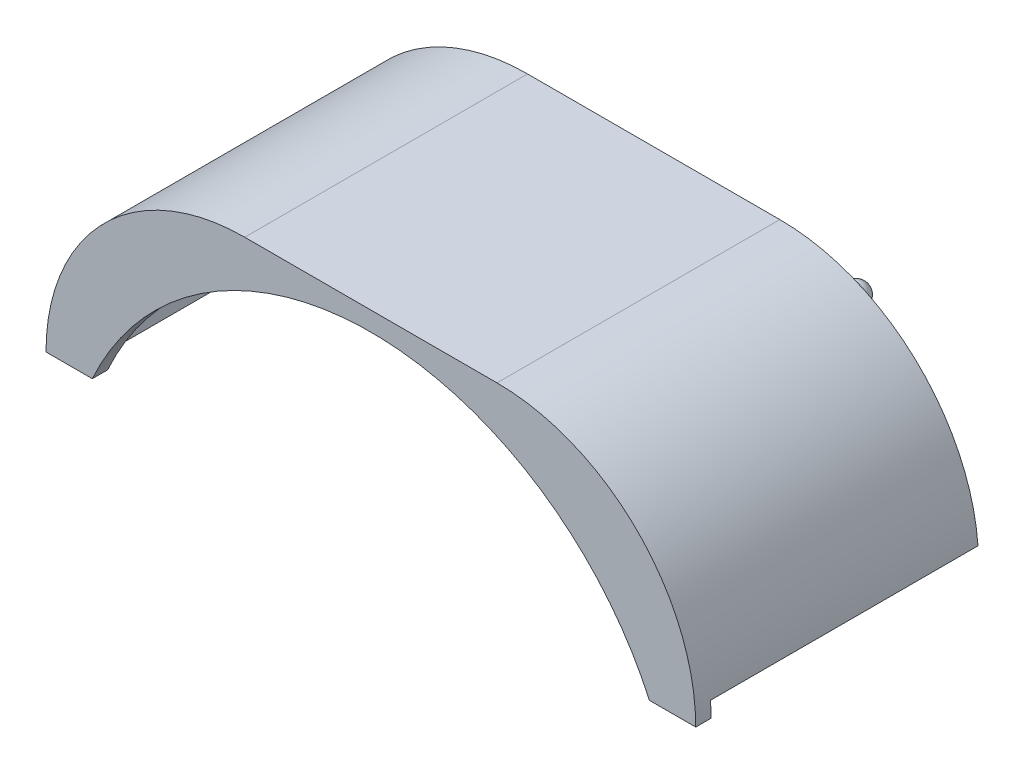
SolidWorks part; units mm, degrees
ref_plane "Face" through (0, 0, 0) normal (0, 0, 1) x (1, 0, 0)
ref_plane "Dessus" through (0, 0, 0) normal (0, 1, 0) x (1, 0, 0)
ref_plane "Droite" through (0, 0, 0) normal (1, 0, 0) x (0, 0, -1)
sketch "Esquisse2" plane through (-29.0881, 3.4934, 0) normal (0, 0, 1) x (1, 0, 0)
  line L0 (11.0881, 35.0066) -> (11.0881, 34.0066)
  line L2 (11.0881, 34.0066) -> (13.0881, 34.0066)
  line L3 (13.0881, 34.0066) -> (13.0881, 38.0066)
  line L4 (46.0881, 35.0066) -> (46.0881, 38.0016)
  line L5 (46.0881, 35.0066) -> (47.0881, 35.0066)
  line L8 (47.0881, 35.0066) -> (47.0881, 34.0066)
  line L9 (-10.4119, 13.0066) -> (-10.4119, 15.0066)
  line L10 (-10.4119, 15.0066) -> (-13.3349, 15.0066)
  line L11 (-10.4119, 13.0066) -> (-9.4119, 13.0066)
  line L13 (45.5881, 39.0066) -> (12.5881, 39.0066)
  line L14 (13.0881, 38.0066) -> (45.0881, 38.0066)
  line L15 (55.5881, 35.9195) -> (55.5881, 34.0066)
  line L16 (-9.4119, 13.0066) -> (-9.4119, 24.8809)
  line L17 (52.5881, 34.0066) -> (52.5881, 37.0066)
  line L18 (68.5881, 15.0066) -> (71.511, 15.0066)
  line L19 (5.5881, 37.0066) -> (5.5881, 34.0066)
  line L20 (68.5881, 15.0066) -> (68.5881, 13.0066)
  line L21 (2.5881, 34.0066) -> (2.5881, 35.9195)
  line L22 (68.5881, 13.0066) -> (67.5881, 13.0066)
  line L24 (67.5881, 13.0066) -> (67.5881, 24.8809)
  line L25 (12.0881, 35.0066) -> (12.0881, 38.0016)
  line L26 (12.0881, 35.0066) -> (11.0881, 35.0066)
  line L28 (47.0881, 34.0066) -> (45.0881, 34.0066)
  line L29 (45.0881, 34.0066) -> (45.0881, 38.0066)
  line L30 (68.5881, 13.0066) -> (68.5881, 15.0066) construction
  line L31 (70.508, 15.0066) -> (68.5881, 15.0066) construction
  line L32 (65.5264, 13.0066) -> (70.5881, 13.0066) construction
  line L33 (-10.4119, 13.0066) -> (-10.4119, 15.0066) construction
  line L34 (-10.4119, 15.0066) -> (-12.3318, 15.0066) construction
  line L35 (-12.4119, 13.0066) -> (-7.3502, 13.0066) construction
  line L36 (45.5881, 39.0066) -> (12.5881, 39.0066) construction
  line L37 (12.0881, 35.0066) -> (11.0881, 35.0066) construction
  line L38 (11.0881, 35.0066) -> (11.0881, 32.2277) construction
  line L39 (14.0881, 38.0066) -> (12.5881, 38.0066) construction
  line L40 (12.0881, 36.0066) -> (12.0881, 35.0066) construction
  line L41 (47.0881, 32.2277) -> (47.0881, 35.0066) construction
  line L42 (47.0881, 35.0066) -> (46.0881, 35.0066) construction
  line L43 (46.0881, 35.0066) -> (46.0881, 36.0066) construction
  arc A4 (67.5881, 24.8809) -> (55.5881, 35.9195) centre (45.5881, 13.0066) ccw
  arc A5 (12.0881, 38.0016) -> (5.5881, 37.0066) centre (12.5881, 13.0066) ccw
  arc A6 (12.5881, 39.0066) -> (-13.3349, 15.0066) centre (12.5881, 13.0066) ccw
  arc A7 (71.511, 15.0066) -> (45.5881, 39.0066) centre (45.5881, 13.0066) ccw
  arc A10 (2.5881, 34.0066) -> (5.5881, 34.0066) centre (4.0881, 34.0066) ccw
  arc A11 (52.5881, 34.0066) -> (55.5881, 34.0066) centre (54.0881, 34.0066) ccw
  arc A12 (2.5881, 35.9195) -> (-9.4119, 24.8809) centre (12.5881, 13.0066) ccw
  arc A13 (52.5881, 37.0066) -> (46.0881, 38.0016) centre (45.5881, 13.0066) ccw
  arc A14 (71.5881, 13.0066) -> (45.5881, 39.0066) centre (45.5881, 13.0066) ccw construction
  arc A15 (70.508, 15.0066) -> (45.5881, 38.0066) centre (45.5881, 13.0066) ccw construction
  circle A16 centre (54.0881, 34.0066) radius 1.5 construction
  arc A17 (12.5881, 38.0066) -> (-12.3318, 15.0066) centre (12.5881, 13.0066) ccw construction
  circle A18 centre (4.0881, 34.0066) radius 1.5 construction
  arc A19 (12.5881, 39.0066) -> (-13.4119, 13.0066) centre (12.5881, 13.0066) ccw construction
  dimension "D1" = 1
  dimension "D2" = 1
  dimension "D3" = 1
extrude "Base-Extrusion" add sketch "Esquisse2" along normal up to surface (35 mm away)
sketch "Esquisse3" plane through (0, 0, 35) normal (0, 0, 1) x (1, 0, 0)
  line L0 (-16.5, 42.5) -> (16.5, 42.5) construction
  line L1 (-16.5, 42.5) -> (16.5, 42.5)
  line L2 (-42.5, 16.5) -> (-36.4383, 16.5)
  line L3 (36.4383, 16.5) -> (42.5, 16.5)
  arc A0 (36.4383, 16.5) -> (-36.4383, 16.5) centre (0, 0) ccw construction
  arc A1 (42.5, 16.5) -> (16.5, 42.5) centre (16.5, 16.5) ccw construction
  arc A2 (-16.5, 42.5) -> (-42.5, 16.5) centre (-16.5, 16.5) ccw construction
  arc A3 (36.4383, 16.5) -> (-36.4383, 16.5) centre (0, 0) ccw
  arc A4 (42.5, 16.5) -> (16.5, 42.5) centre (16.5, 16.5) ccw
  arc A5 (-16.5, 42.5) -> (-42.5, 16.5) centre (-16.5, 16.5) ccw
extrude "Boss.-Extru.1" add sketch "Esquisse3" along normal up to surface (2 mm away)
sketch "Esquisse4" plane through (0, 0, 0) normal (0, 0, -1) x (-1, 0, 0)
  line L1 (18, 37.5) -> (16, 37.5)
  line L2 (18, 37.5) -> (18, 41.5)
  line L3 (18, 41.5) -> (16, 41.5)
  line L4 (16, 37.5) -> (16, 41.5)
  line L5 (-18, 37.5) -> (-16, 37.5)
  line L6 (-18, 37.5) -> (-18, 41.5)
  line L7 (-18, 41.5) -> (-16, 41.5)
  line L8 (-16, 37.5) -> (-16, 41.5)
extrude "Enlèv. mat.-Extru.1" cut sketch "Esquisse4" against normal blind 30
sketch "Esquisse5" plane through (0, 0, 0) normal (0, 0, -1) x (-1, 0, 0)
  circle A0 centre (25, 37.5) radius 1.5
  circle A1 centre (-25, 37.5) radius 1.5
  arc A2 (23.5, 37.5) -> (26.5, 37.5) centre (25, 37.5) ccw construction
  arc A3 (-26.5, 37.5) -> (-23.5, 37.5) centre (-25, 37.5) ccw construction
extrude "Boss.-Extru.2" add sketch "Esquisse5" along normal blind 3
fillet "Congé1" radius 1.5 2 edges at (23.5, 37.5, -3) (-26.5, 37.5, -3)
